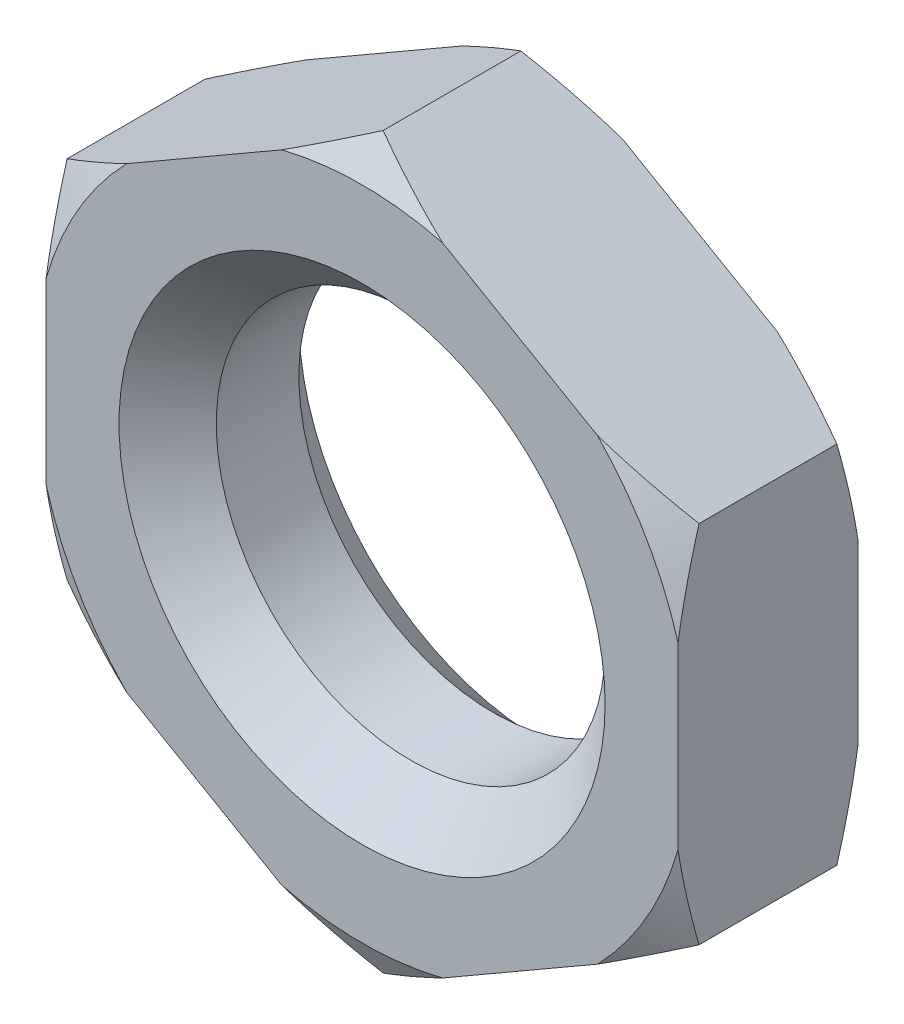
SolidWorks part; units mm, degrees
ref_plane "Front Plane" through (0, 0, 0) normal (0, 0, 1) x (1, 0, 0)
ref_plane "Top Plane" through (0, 0, 0) normal (0, 1, 0) x (1, 0, 0)
ref_plane "Right Plane" through (0, 0, 0) normal (1, 0, 0) x (0, 0, -1)
sketch "Sketch1" plane through (0, 0, 0) normal (0, 0, 1) x (1, 0, 0)
  line L1 (0, 7.5056) -> (-6.5, 3.7528)
  line L2 (-6.5, 3.7528) -> (-6.5, -3.7528)
  line L3 (-6.5, -3.7528) -> (0, -7.5056)
  line L4 (0, -7.5056) -> (6.5, -3.7528)
  line L5 (6.5, -3.7528) -> (6.5, 3.7528)
  line L6 (6.5, 3.7528) -> (0, 7.5056)
  circle A0 centre (0, 0) radius 6.5 construction
  circle A1 centre (0, 0) radius 4
  dimension "D2" = 8
  dimension "D1" = 13
extrude "Boss-Extrude1" add sketch "Sketch1" along normal mid plane 3.7
sketch "Sketch2" plane through (0, 0, 0) normal (1, 0, 0) x (0, 0, -1)
  line L0 (7.477, 0) -> (-8.5759, 0) construction
sketch "Sketch3" plane through (0, 0, 0) normal (1, 0, 0) x (0, 0, -1)
  line L0 (-1.85, 7.5056) -> (-1.85, 6.7556)
  line L1 (-1.85, 3.7528) -> (-1.85, 7.5056) construction
  line L2 (-1.85, 6.7556) -> (-1.417, 7.5056)
  line L3 (-1.85, 7.5056) -> (1.85, 7.5056) construction
  line L4 (-1.417, 7.5056) -> (-1.85, 7.5056)
  dimension "D1" = 0.75
  dimension "D2" = 30
revolve "Cut-Revolve1" cut sketch "Sketch3" angle 360 about L0
mirror "Mirror1" about plane through (0, 0, 0) normal (0, 0, 1) of "Cut-Revolve1"
chamfer "Chamfer1" distance 1 angle 45 2 edges at (4, 0, -1.85) (4, 0, 1.85)
